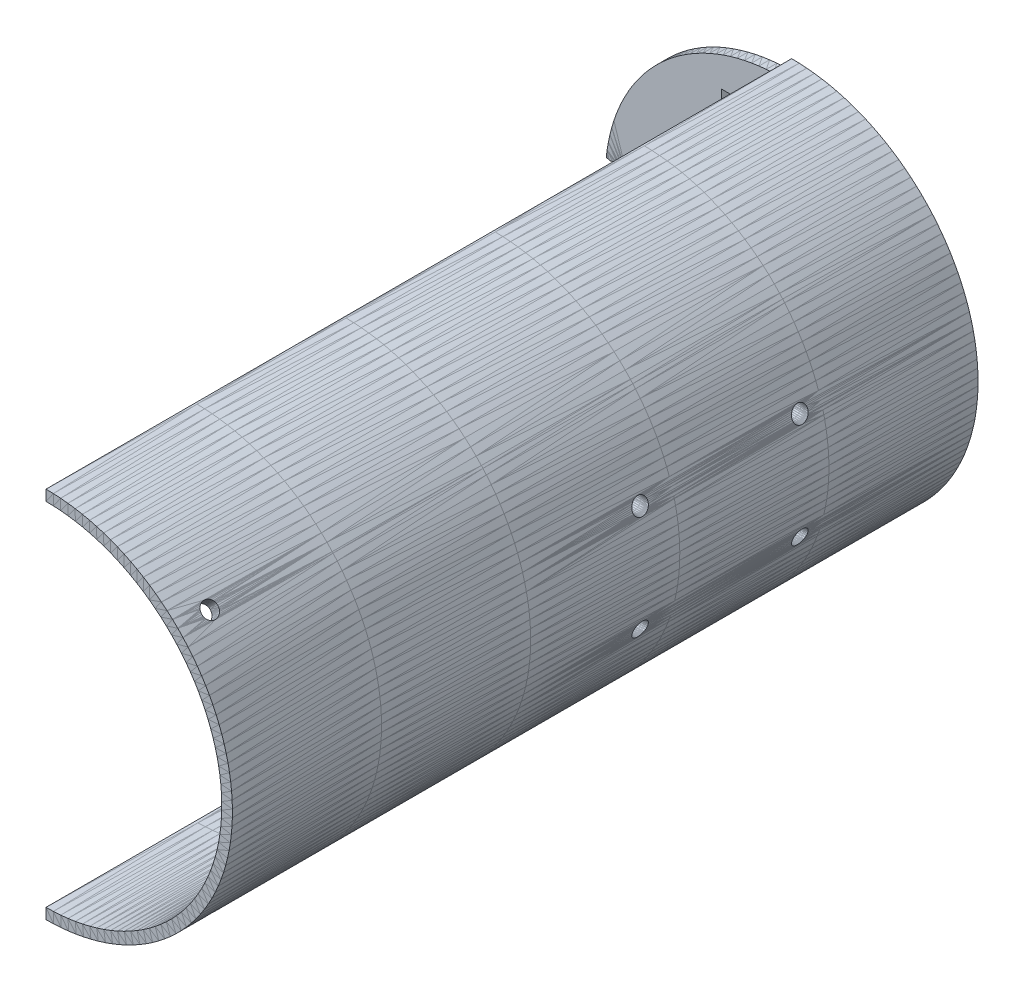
SolidWorks part; units mm, degrees
ref_plane "Front Plane" through (0, 0, 0) normal (0, 0, 1) x (1, 0, 0)
ref_plane "Top Plane" through (0, 0, 0) normal (0, 1, 0) x (1, 0, 0)
ref_plane "Right Plane" through (0, 0, 0) normal (1, 0, 0) x (0, 0, -1)
imported_body "Imported1"
imported_body "Imported2"
sketch "Sketch1" plane through (4.6582, 0, 0) normal (-1, 0, 0) x (0, 0, 1)
  line L9 (3.2551, 29.7) -> (149.126, 29.7)
  line L10 (3.2551, 29.7) -> (3.2551, -29.6408)
  line L11 (3.2551, -29.6408) -> (149.126, -29.6408)
  line L12 (149.126, 29.7) -> (149.126, -29.6408)
extrude "Cut-Extrude1" cut sketch "Sketch1" along normal blind 26
sketch "Sketch2" plane through (4.6582, 0, 0) normal (-1, 0, 0) x (0, 0, 1)
  line L0 (53.3746, 0) -> (10.1023, -10.9074) construction
  line L1 (17.4377, -9.0584) -> (5.1713, -9.0584)
  line L2 (17.4377, -9.0584) -> (17.4377, -19.6145)
  line L3 (17.4377, -19.6145) -> (5.1713, -19.6145)
  line L4 (5.1713, -9.0584) -> (5.1713, -19.6145)
  line L5 (53.3746, 0) -> (59.4443, 10.4082) construction
  line L6 (71.8785, 17.5987) -> (58.6927, 17.5987)
  line L7 (71.8785, 17.5987) -> (71.8785, 9.1194)
  line L8 (71.8785, 9.1194) -> (58.6927, 9.1194)
  line L9 (58.6927, 17.5987) -> (58.6927, 9.1194)
extrude "Boss-Extrude1" add sketch "Sketch2" against normal up to surface (2 mm away)
sketch "Sketch3" plane through (0, 0, 2) normal (0, 0, 1) x (1, 0, 0)
  line L1 (-17.1258, 29.0213) -> (2.2283, 29.0213)
  line L2 (-17.1258, 29.0213) -> (-17.1258, -10.0866)
  line L3 (-17.1258, -10.0866) -> (2.2283, -10.0866)
  line L4 (2.2283, 29.0213) -> (2.2283, -10.0866)
extrude "Boss-Extrude2" add sketch "Sketch3" against normal up to surface (2 mm away)
sketch "Sketch5" plane through (4.6582, 0, 0) normal (-1, 0, 0) x (0, 0, 1)
  line L0 (53.3746, 0) -> (158.3457, 0) construction
sketch "Sketch6" plane through (4.6582, 0, 0) normal (-1, 0, 0) x (0, 0, 1)
  line L0 (28.9728, 25.8129) -> (28.3321, 23.19) construction
  line L1 (86.9728, 25.8129) -> (86.3321, 23.19) construction
  line L2 (87.0633, -23.2196) -> (86.2416, -25.7915) construction
  line L3 (28.9728, -23.1941) -> (28.3321, -25.817) construction
  circle A0 centre (28.6524, 24.5015) radius 1.25
  circle A1 centre (28.6524, 24.5015) radius 2.75
  circle A2 centre (86.6524, 24.5015) radius 1.25
  circle A3 centre (86.6524, 24.5015) radius 2.75
  circle A4 centre (86.6524, -24.5055) radius 1.25
  circle A5 centre (86.6524, -24.5055) radius 2.75
  circle A6 centre (28.6524, -24.5055) radius 1.25
  circle A7 centre (28.6524, -24.5055) radius 2.75
  dimension "D1" = 2.5
  dimension "D3" = 2.5
  dimension "D5" = 2.5
  dimension "D7" = 2.5
  dimension "D2" = 1.5
  dimension "D4" = 1.5
  dimension "D6" = 1.5
  dimension "D8" = 1.5
extrude "Boss-Extrude3" add sketch "Sketch6" along normal blind 2.3
sketch "Sketch9" plane through (0, 0, 0) normal (0, 0, -1) x (-1, 0, 0)
  line L0 (-1.1563, 25.8512) -> (-1.1563, -25.8512) construction
  line L1 (-1.1563, -9.7787) -> (12.3482, -9.7787)
  line L2 (-1.1563, -9.7787) -> (-1.1563, -25.6733)
  line L3 (-1.1563, -25.6733) -> (12.3482, -25.6733)
  line L4 (12.3482, -9.7787) -> (12.3482, -25.6733)
  line L6 (14.2488, -5.4755) -> (0.3042, -5.4755)
  line L7 (14.2488, -5.4755) -> (14.2488, 7.4785)
  line L8 (14.2488, 7.4785) -> (0.3042, 7.4785)
  line L9 (0.3042, -5.4755) -> (0.3042, 7.4785)
  line L10 (0.3042, 12.5245) -> (14.2488, 12.5245)
  line L11 (0.3042, 12.5245) -> (0.3042, 25.4785)
  line L12 (0.3042, 25.4785) -> (14.2488, 25.4785)
  line L13 (14.2488, 12.5245) -> (14.2488, 25.4785)
extrude "Cut-Extrude2" cut sketch "Sketch9" against normal blind 15.3
sketch "Sketch10" plane through (4.6582, 0, 0) normal (-1, 0, 0) x (0, 0, 1)
  circle A0 centre (86.6524, -24.5055) radius 1.25 construction
  circle A1 centre (28.6524, -24.5055) radius 1.25 construction
  circle A2 centre (28.6524, 24.5015) radius 1.25 construction
  circle A3 centre (86.6524, 24.5015) radius 1.25 construction
  circle A4 centre (86.6524, -24.5055) radius 1.25
  circle A5 centre (28.6524, -24.5055) radius 1.25
  circle A6 centre (28.6524, 24.5015) radius 1.25
  circle A7 centre (86.6524, 24.5015) radius 1.25
extrude "Cut-Extrude3" cut sketch "Sketch10" against normal blind 3
